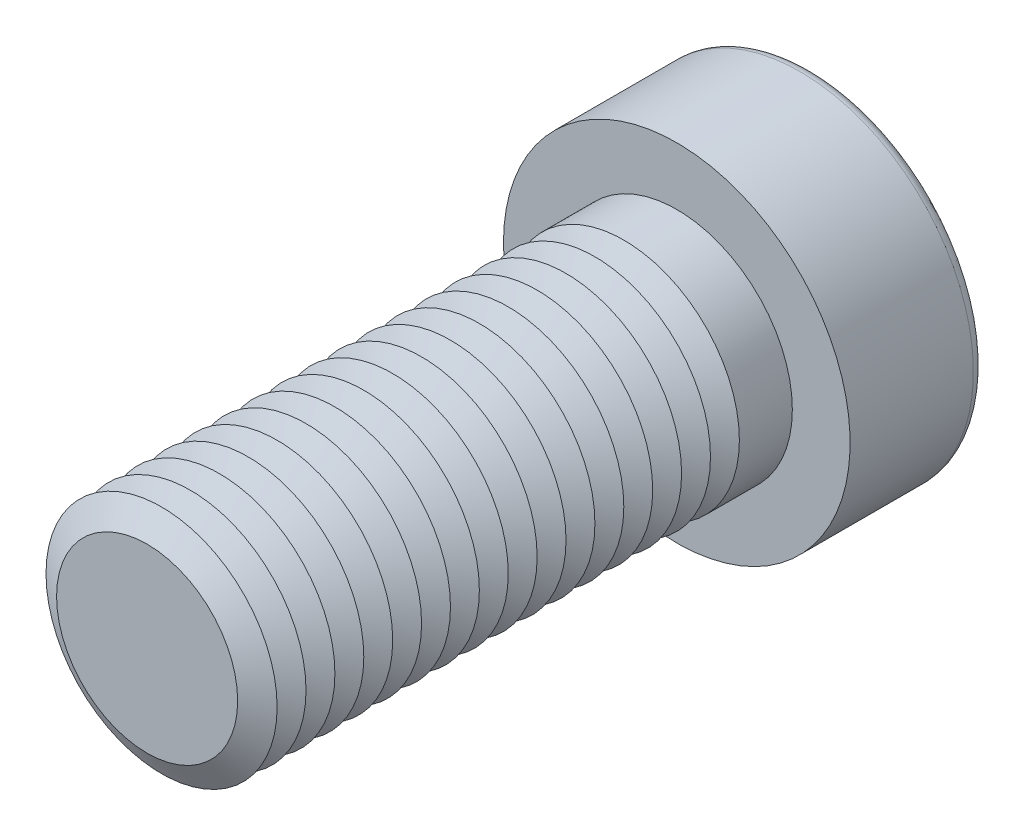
SolidWorks part; units mm, degrees
ref_plane "Front Plane" through (0, 0, 0) normal (0, 0, 1) x (1, 0, 0)
ref_plane "Top Plane" through (0, 0, 0) normal (0, 1, 0) x (1, 0, 0)
ref_plane "Right Plane" through (0, 0, 0) normal (1, 0, 0) x (0, 0, -1)
sketch "Sketch1" plane through (0, 0, 0) normal (0, 0, 1) x (1, 0, 0)
  circle A0 centre (0, 0) radius 12
  dimension "D1" = 24
extrude "Boss-Extrude1" add sketch "Sketch1" along normal blind 55
sketch "Sketch2" plane through (0, 0, 0) normal (0, 0, -1) x (-1, 0, 0)
  circle A0 centre (0, 0) radius 18
  dimension "D1" = 36
extrude "Boss-Extrude2" add sketch "Sketch2" along normal blind 14
sketch "Sketch3" plane through (0, 0, -14) normal (0, 0, -1) x (-1, 0, 0)
  line L1 (-5.4848, 9.5) -> (-10.9697, 0)
  line L2 (-10.9697, 0) -> (-5.4848, -9.5)
  line L3 (-5.4848, -9.5) -> (5.4848, -9.5)
  line L4 (5.4848, -9.5) -> (10.9697, 0)
  line L5 (10.9697, 0) -> (5.4848, 9.5)
  line L6 (5.4848, 9.5) -> (-5.4848, 9.5)
  circle A0 centre (0, 0) radius 9.5 construction
  dimension "D1" = 19
extrude "Cut-Extrude1" cut sketch "Sketch3" against normal blind 14.25
fillet "Fillet1" radius 1.2 1 edges at (-18, 0, -14)
sketch "Sketch4" plane through (0, 0, 0.25) normal (0, 0, -1) x (-1, 0, 0)
  line L0 (5.4848, -9.5) -> (10.9697, 0) construction
  circle A0 centre (0, 0) radius 9.5
extrude "Cut-Extrude2" cut sketch "Sketch4" against normal through all draft 60
sketch "Sketch5" plane through (0, 0, -14) normal (0, 0, -1) x (-1, 0, 0)
  circle A0 centre (0, 0) radius 10.9697
extrude "Cut-Extrude3" cut sketch "Sketch5" against normal through all draft 75
sketch "Sketch7" plane through (0, 0, 0) normal (1, 0, 0) x (0, 0, -1)
  line L25 (-55, 9.4019) -> (-53.5, 12)
  line L26 (-55, 12) -> (-55, -12) construction
  line L27 (-53.5, 12) -> (-56.5, 12)
  line L28 (-56.5, 12) -> (-55, 9.4019)
  line L29 (0, 12) -> (-55, 12) construction
  dimension "D1" = 3
revolve "Cut-Revolve1" cut sketch "Sketch7" angle 360 about axis through (0, 0, 55) along (0, 0, -1)
pattern_linear "LPattern1" count 17 spacing 3 along (0, 0, -1) of "Cut-Revolve1"
